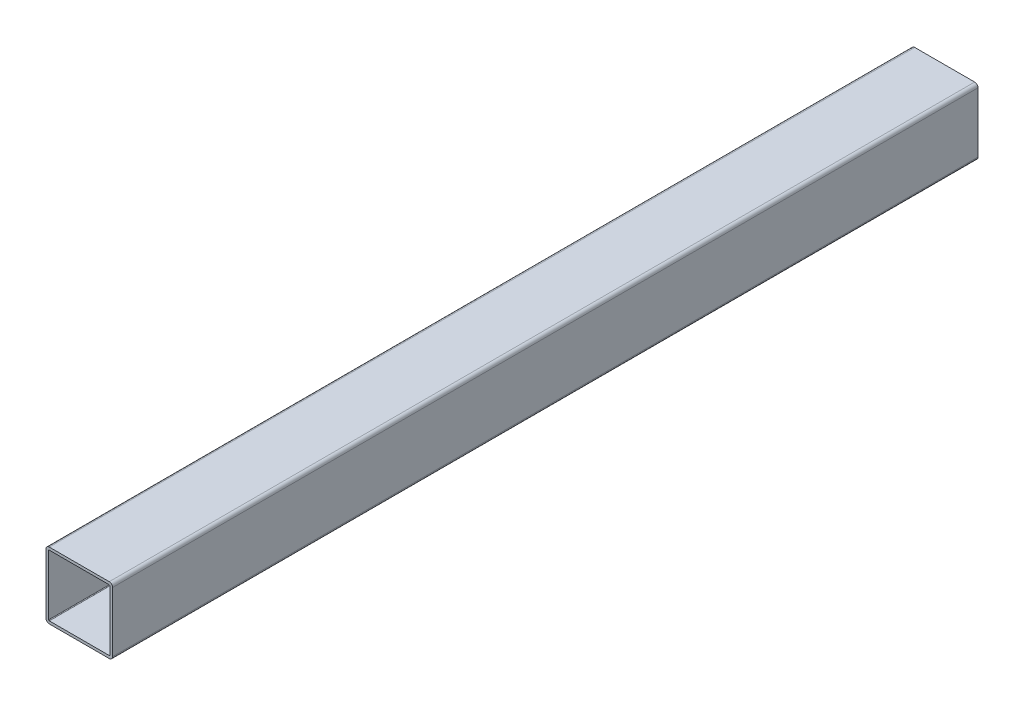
SolidWorks part; units mm, degrees
ref_plane "Face" through (0, 0, 0) normal (0, 0, 1) x (1, 0, 0)
ref_plane "Dessus" through (0, 0, 0) normal (0, 1, 0) x (1, 0, 0)
ref_plane "Droite" through (0, 0, 0) normal (1, 0, 0) x (0, 0, -1)
sketch "Esquisse1" plane through (0, 0, 0) normal (0, 0, 1) x (1, 0, 0)
  line L0 (5, -4) -> (95, -4)
  line L1 (5, 0) -> (95, 0)
  line L2 (0, -5) -> (0, -95)
  line L3 (5, -100) -> (95, -100)
  line L4 (100, -5) -> (100, -95)
  line L5 (96, -5) -> (96, -95)
  line L6 (5, -96) -> (95, -96)
  line L7 (4, -5) -> (4, -95)
  arc A0 (95, -100) -> (100, -95) centre (95, -95) ccw
  arc A1 (0, -95) -> (5, -100) centre (5, -95) ccw
  arc A2 (5, 0) -> (0, -5) centre (5, -5) ccw
  arc A3 (100, -5) -> (95, 0) centre (95, -5) ccw
  arc A4 (96, -5) -> (95, -4) centre (95, -5) ccw
  arc A5 (95, -96) -> (96, -95) centre (95, -95) ccw
  arc A6 (4, -95) -> (5, -96) centre (5, -95) ccw
  arc A7 (5, -4) -> (4, -5) centre (5, -5) ccw
  point P9 (0, -100)
  point P12 (0, 0)
  point P15 (100, 0)
  dimension "D3" = 5
  dimension "D1" = 100
  dimension "D2" = 100
  dimension "D4" = 4
extrude "Base-Extrusion" add sketch "Esquisse1" along normal blind 1300
sketch "Esquisse2" plane through (0, 0, 0) normal (-1, 0, 0) x (0, 0, 1)
  line L0 (0, -5) -> (0, -95) construction
  line L1 (1300, 0) -> (0, 0) construction
  circle A0 centre (300, -50) radius 2.5
  circle A1 centre (1000, -50) radius 2.5
  dimension "D4" = 5
  dimension "D1" = 300
  dimension "D2" = 1000
  dimension "D3" = 50
extrude "Enlèv. mat.-Extru.1" cut sketch "Esquisse2" against normal blind 6
